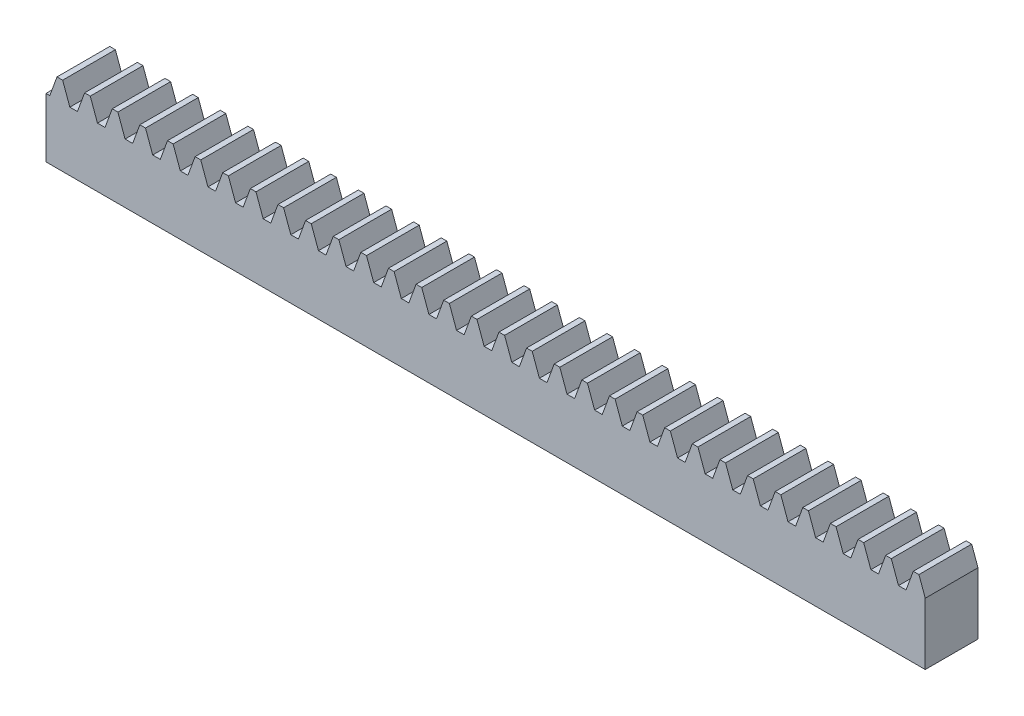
SolidWorks part; units mm, degrees
ref_plane "Plane1" through (0, 0, 0) normal (0, 0, 1) x (1, 0, 0)
ref_plane "Plane2" through (0, 0, 0) normal (0, 1, 0) x (1, 0, 0)
ref_plane "Plane3" through (0, 0, 0) normal (1, 0, 0) x (0, 0, -1)
sketch "HoldingSke" plane through (0, 0, 0) normal (0, 1, 0) x (1, 0, 0)
  line L0 (0, 0) -> (0.0278, 0.1981)
  line L1 (-15, 0) -> (100, 0) construction
  line L2 (0, 0) -> (-2.1039, 2.3779)
  line L3 (0, 0) -> (-11.863, 4.5341)
  line L4 (0, 0) -> (7.2428, 4.7035)
  line L5 (0, 0) -> (-23.7986, -8.8762)
  line L6 (0, 0) -> (-10.5278, -7.1032)
  line L9 (-71.009, 38.7566) -> (398.8373, 209.7667)
  line L10 (-76.2, 7.3779) -> (-36.2, 7.3779)
  line L11 (0, 0) -> (-20, 0)
  line L12 (-76.2, 101.6) -> (-76.033, 101.6)
  line L13 (24.9733, 27.94) -> (52.9518, 28.4284)
  line L14 (24.9733, 27.94) -> (24.9743, 27.94)
  line L15 (24.9733, 27.94) -> (100.4006, 29.5858)
  circle A0 centre (0, 0) radius 19.05
  circle A1 centre (0, 0) radius 20
  circle A2 centre (0, 0) radius 12.7
  dimension "MPH" = 40
  dimension "Diameter" = 38.1
  dimension "Num_teeth" = 33
  dimension "Pitch" = 0.2
  dimension "Width" = 20
  dimension "Show_teeth" = 998
  dimension "Thickness" = 12.7
  dimension "Ap" = 20
  dimension "Pitch_height" = 40
  dimension "Backlash" = 0.167
  dimension "Addendum_fac" = 1
  dimension "Dedendum_fac" = 1.25
  dimension "Clearance_fac" = 0.25
  dimension "Dedendum_add" = 0.001
  dimension "Length" = 500
  dimension "Module" = 5
sketch "BlankSke" plane through (0, 0, 0) normal (0, 0, 1) x (1, 0, 0)
  line L1 (0, 0) -> (500, 0)
  line L2 (0, 0) -> (0, 45)
  line L3 (0, 45) -> (500, 45)
  line L4 (500, 0) -> (500, 45)
  dimension "Length" = 500
  dimension "Blank_height" = 45
extrude "Blank" add sketch "BlankSke" against normal blind 30
sketch "TooCutSkeIll" plane through (0, 0, 0) normal (0, 0, 1) x (1, 0, 0)
  line L0 (-6.1999, 44.8684) -> (-2.4528, 34.5731)
  line L1 (-1.2772, 33.75) -> (1.2772, 33.75)
  line L2 (2.4528, 34.5731) -> (6.1999, 44.8684)
  line L3 (500, 45) -> (0, 45) construction
  line L4 (0, 0) -> (0, 64.897) construction
  line L5 (-13.208, 40) -> (12.954, 40) construction
  line L6 (0, 0) -> (500, 0) construction
  line L7 (4.428, 40) -> (4.428, 48.7463) construction
  line L8 (-4.428, 40) -> (-4.428, 48.7463) construction
  line L9 (6.3879, 45) -> (6.3879, 45.0254)
  line L10 (-6.3879, 45) -> (-6.3879, 45.0254)
  line L11 (-6.3879, 45.0254) -> (6.3879, 45.0254)
  arc A0 (1.2772, 33.75) -> (2.4528, 34.5731) centre (1.2772, 35.001) ccw
  arc A1 (-2.4528, 34.5731) -> (-1.2772, 33.75) centre (-1.2772, 35.001) ccw
  arc A2 (6.3879, 45) -> (6.1999, 44.8684) centre (6.3879, 44.8) ccw
  arc A3 (-6.1999, 44.8684) -> (-6.3879, 45) centre (-6.3879, 44.8) ccw
  dimension "Root_fillet" = 1.251
  dimension "Break_rad" = 0.2
  dimension "Pitch_height" = 40
  dimension "Gap_width" = 8.856
  dimension "Dedendum" = 6.25
  dimension "Addendum_plus" = 5.0254
  dimension "Pressure_angle" = 20
extrude "ToothCutIll" [suppressed] cut sketch "TooCutSkeIll" against normal through all
sketch "TooCutSkeSim" plane through (0, 0, 0) normal (0, 0, 1) x (1, 0, 0)
  line L0 (2.1532, 33.75) -> (-2.1532, 33.75)
  line L1 (6.2571, 45.0254) -> (2.1532, 33.75)
  line L2 (0, 17.4625) -> (0, 53.467) construction
  line L3 (6.2571, 45.0254) -> (-6.2571, 45.0254)
  line L6 (-6.2571, 45.0254) -> (-2.1532, 33.75)
  line L9 (-4.428, 40) -> (4.428, 40) construction
  line L10 (0, 0) -> (500, 0) construction
  line L11 (4.428, 40) -> (4.428, 53.467) construction
  line L12 (-4.428, 40) -> (-4.428, 53.467) construction
  dimension "Pitch_height" = 40
  dimension "Pressure_angle" = 20
  dimension "Gap_width" = 8.856
  dimension "Dedendum" = 6.25
  dimension "Addendum_plus" = 5.0254
extrude "ToothCutSim" cut sketch "TooCutSkeSim" against normal through all
pattern_linear "TeethCuts" count 32 spacing 15.708 along (1, 0, 0) of "ToothCutIll", "ToothCutSim"
scale "Scale1" scale about centroid uniform scaling yes scale factor 0.25
equation "' \"Module@HoldingSke\" = 6.35"
equation "' \"Num_teeth@HoldingSke\" = 12"
equation "' \"Ap@HoldingSke\" =  20"
equation "' \"Width@HoldingSke\" = 0.25 * 25.4"
equation "' \"Show_teeth@HoldingSke\" = 500"
equation "' \"Backlash@HoldingSke\" = 0.009 * 25.4"
equation "' \"Addendum_fac@HoldingSke\" = 1.0"
equation "' \"Dedendum_fac@HoldingSke\" = 1.25"
equation "' \"Dedendum_add@HoldingSke\" = 0.00005 * 25.4"
equation "' \"Clearance_fac@HoldingSke\" = 0.25"
equation "' \"Pitch_height@HoldingSke\" = 1 * 25.4"
equation "' \"Length@HoldingSke\" = 4.71 * 25.4"
equation "\"Pitch@HoldingSke\" = 1 / \"Module@HoldingSke\""
equation "\"MPH@HoldingSke\" = \"Dedendum_fac@HoldingSke\" / \"Pitch@HoldingSke\" + 2 * \"Dedendum_add@HoldingSke\" + 0.002 * 25.4"
equation "\"MPH@HoldingSke\" = ((sgn( \"MPH@HoldingSke\" - \"Pitch_height@HoldingSke\")+1)*( \"MPH@HoldingSke\" - \"Pitch_height@HoldingSke\"))/2 + \"Pitch_height@HoldingSke\""
equation "\"Blank_height@BlankSke\" = \"Pitch_height@HoldingSke\" + \"Addendum_fac@HoldingSke\"  / \"Pitch@HoldingSke\" "
equation "\"Length@BlankSke\" =  \"Length@HoldingSke\""
equation "\"Pressure_angle@TooCutSkeIll\" = \"Ap@HoldingSke\""
equation "\"Addendum_plus@TooCutSkeIll\" =  \"Addendum_fac@HoldingSke\"  / \"Pitch@HoldingSke\" + 0.001 *25.4"
equation "\"Dedendum@TooCutSkeIll\" = \"Dedendum_fac@HoldingSke\"  / \"Pitch@HoldingSke\""
equation "\"Pitch_height@TooCutSkeIll\" =  \"MPH@HoldingSke\""
equation "\"Gap_width@TooCutSkeIll\" = 3.14159265 / 2 / \"Pitch@HoldingSke\" + 6 * \"Backlash@HoldingSke\""
equation "\"Pressure_angle@TooCutSkeSim\" = \"Ap@HoldingSke\""
equation "\"Addendum_plus@TooCutSkeSim\" =  \"Addendum_fac@HoldingSke\"  / \"Pitch@HoldingSke\" + 0.001 * 25.4"
equation "\"Dedendum@TooCutSkeSim\" = \"Dedendum_fac@HoldingSke\"  / \"Pitch@HoldingSke\""
equation "\"Pitch_height@TooCutSkeSim\" =  \"MPH@HoldingSke\""
equation "\"Gap_width@TooCutSkeSim\" = 3.14159265 / 2 / \"Pitch@HoldingSke\" + 6 * \"Backlash@HoldingSke\""
equation "\"Root_fillet@TooCutSkeIll\" = \"Clearance_fac@HoldingSke\" / \"Pitch@HoldingSke\" + \"Dedendum_add@HoldingSke\""
equation "\"Break_rad@TooCutSkeIll\" = 0.02 / \"Pitch@HoldingSke\" * 2"
equation "\"Linear_pitch@TeethCuts\" = 3.14159265 / \"Pitch@HoldingSke\""
equation "\"Num_teeth@HoldingSke\" = int( ( \"Length@HoldingSke\" + 0 ) / (3.14159265 / \"Pitch@HoldingSke\")) + 0.9999  + 1"
equation " \"Num_teeth@TeethCuts\" = int( \"Show_teeth@HoldingSke\" ) + 1"
equation " \"Num_teeth@TeethCuts\" = ((sgn( \"Num_teeth@TeethCuts\" - \"Num_teeth@HoldingSke\" )-1)*( \"Num_teeth@TeethCuts\" - \"Num_teeth@HoldingSke\" ))/-2+ \"Num_teeth@HoldingSke\""
equation " \"Num_teeth@TeethCuts\" = ((sgn( \"Num_teeth@TeethCuts\" - 2.0)+1)*( \"Num_teeth@TeethCuts\" - 2.0))/2 +2.0"
